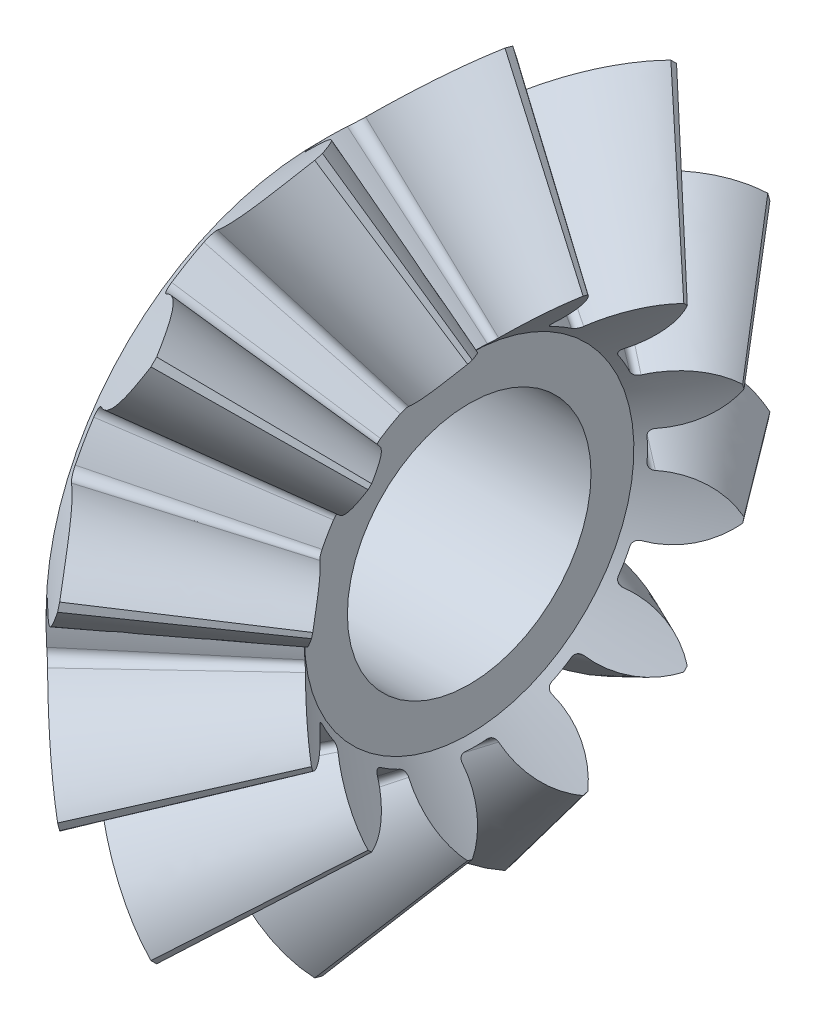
SolidWorks part; units mm, degrees
other "<straight bevel pinion_iso>-<Bore>"
ref_plane "前视基准面" through (0, 0, 0) normal (0, 0, 1) x (1, 0, 0)
ref_plane "上视基准面" through (0, 0, 0) normal (0, 1, 0) x (1, 0, 0)
ref_plane "右视基准面" through (0, 0, 0) normal (1, 0, 0) x (0, 0, -1)
sketch "HoldingSke-straight bevel pinion_iso" plane through (0, 0, 0) normal (0, 1, 0) x (1, 0, 0)
  line L0 (0, 0) -> (1.0868, -0.231)
  line L1 (-15, 0) -> (100, 0) construction
  line L2 (0, 0) -> (-120.4621, 24.3224)
  line L3 (0, 0) -> (-11.863, 4.5341)
  line L4 (0, 0) -> (8.4473, 1.7955)
  line L5 (0, 0) -> (-7.4956, -2.7956)
  line L6 (0, 0) -> (-10.5278, -7.1032)
  line L7 (-120.4621, 24.3224) -> (-120.402, 32.3222)
  line L8 (-76.2, 0.9) -> (-75.5, 0.9)
  line L9 (-71.009, 38.7566) -> (-53.1078, 45.2721)
  line L10 (-76.2, 71.12) -> (104.1128, 71.12)
  line L11 (0, 0) -> (-3, 0)
  line L12 (-76.2, 101.6) -> (-76.166, 101.6)
  line L13 (24.9733, 27.94) -> (52.9518, 28.4284)
  line L14 (24.9733, 27.94) -> (24.9743, 27.94)
  line L15 (24.9733, 27.94) -> (100.4024, 29.5042)
  line L16 (-120.4621, 24.3224) -> (5.8239, -2.5205)
  circle A0 centre (0, 0) radius 2
  circle A1 centre (0, 0) radius 3.5
  circle A2 centre (0, 0) radius 3.5
  circle A3 centre (0, 0) radius 2
  dimension "MHD" = 7
  dimension "Hub_dia" = 7
  dimension "Bore" = 4
  dimension "MBD" = 4
  dimension "Num_teeth" = 12
  dimension "Pitch_radius" = 180.3128
  dimension "Pitch" = 1.1111
  dimension "Width" = 3
  dimension "Mounting_dist" = 8
  dimension "Show_teeth" = 12
  dimension "Thickness" = 12.7
  dimension "OAL" = 8.0001
  dimension "T_dim" = 0.7
  dimension "Ap" = 20
  dimension "H" = 19.05
  dimension "Backlash" = 0.034
  dimension "Addendum_fac" = 1
  dimension "Dedendum_fac" = 1.188
  dimension "Clearance_fac" = 0.188
  dimension "Dedendum_add" = 0.001
  dimension "Mating_teeth" = 12
  dimension "MnMD" = 6.3459
  dimension "Module" = 0.9
inserted part "straight bevel pinion_iso" parameters "Num_teeth.HoldingSke"=12, "Pitch.HoldingSke"=1.1111, "MHD.HoldingSke"=7, "Hub_dia.HoldingSke"=7, "Mounting_dist.HoldingSke"=8, "Show_teeth.HoldingSke"=12, "Thickness.HoldingSke"=12.7, "OAL.HoldingSke"=8.0001, "T_dim.HoldingSke"=0.7, "Ap.HoldingSke"=20, "H.HoldingSke"=19.05, "Pitch_radius.HoldingSke"=180.3128, "Width.HoldingSke"=3, "Bore.HoldingSke"=4, "Backlash.HoldingSke"=0.034, "Addendum_fac.HoldingSke"=1, "Dedendum_fac.HoldingSke"=1.188, "Clearance_fac.HoldingSke"=0.188, "Dedendum_add.HoldingSke"=0.001, "Mating_teeth.HoldingSke"=12, "MnMD.HoldingSke"=6.3459, "MBD.HoldingSke"=4, "Module.HoldingSke"=0.9, "D1.Base-Revolve"=360, "Addendum.BasProSke"=0.9, "Pitch_rad.BasProSke"=5.4, "Dedendum_plus.BasProSke"=1.3377, "Face_wid.BasProSke"=3, "Pitch_ang.BasProSke"=45, "D1.BasProSke"=8.9081, "D2.BasProSke"=6.3459, "D3.BasProSke"=7.6368, "D4.BasProSke"=6.721, "Offset.ToothPln2"=7.6368, "Dedendum_plus.TooCutSke2"=1.3377, "Diameter.TooCutSke2"=0.0254, "Radius.TooCutSke"=6.3, "Overcut_dia.TooCutSke"=12.852, "Root_dia.TooCutSke"=8.6596, "Pitch_dia.TooCutSke"=10.8, "Base_dia.TooCutSke"=10.1487, "Half_ang.TooCutSke"=15, "Half_CT.TooCutSke"=0.6878, "Flank_rad.TooCutSke"=2.16, "Root_fillet.TooCutSke"=0.1702, "Angle.TeethCuts"=30, "Num_teeth.TeethCuts"=12, "Length.Hub"=1.6542, "Diameter.HubSke"=7, "D1.Bore"=16.0001, "Diameter.BorSke"=4
move or copy body "实体-移动/复制4"
sketch "草图11" plane through (-1.6542, 0, 0) normal (-1, 0, 0) x (0, 0, 1)
  circle A0 centre (0, 0) radius 3.5
  dimension "D1" = 7
extrude "切除-拉伸3" cut sketch "草图11" against normal blind 1.15
chamfer "倒角2" distance 0.2 angle 45 1 edges at (-0.5042, 0, 3.5)
